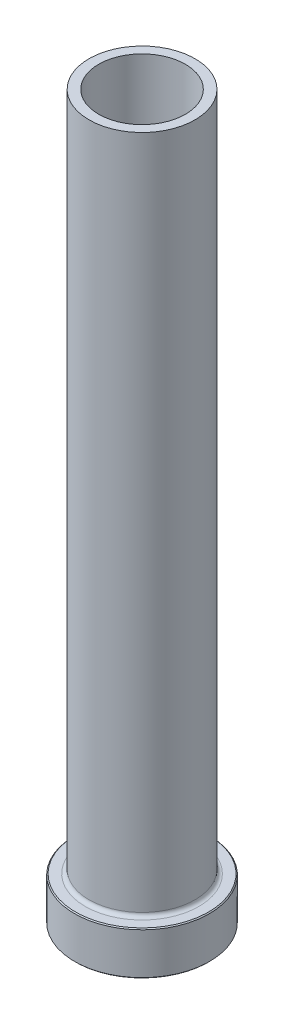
SolidWorks part; units mm, degrees
ref_plane "Front Plane" through (0, 0, 0) normal (0, 0, 1) x (1, 0, 0)
ref_plane "Top Plane" through (0, 0, 0) normal (0, 1, 0) x (1, 0, 0)
ref_plane "Right Plane" through (0, 0, 0) normal (1, 0, 0) x (0, 0, -1)
sketch "Sketch1" plane through (0, 0, 0) normal (0, 0, 1) x (1, 0, 0)
  line L0 (-9, 150) -> (-11, 150)
  line L1 (-11, 150) -> (-11, 9)
  line L2 (-11, 9) -> (-14, 9)
  line L3 (-14, 9) -> (-14, 0)
  line L4 (15.4, 0) -> (-15.4, 0) construction
  line L5 (-14, 0) -> (-9.25, 0)
  line L6 (-9, 95) -> (-9, 150)
  line L7 (0, 92.1877) -> (0, -15.5353) construction
  line L8 (0, -15.4) -> (0, 15.4) construction
  line L9 (-9, 95) -> (-9.25, 83)
  line L10 (-9.25, 83) -> (-9.25, 0)
  dimension "D1" = 0.25
  dimension "ID" = 18
  dimension "OD" = 22
  dimension "L" = 150
  dimension "H" = 28
  dimension "T" = 9
  dimension "N" = 55
  dimension "D2" = 12
revolve "Revolve1" add sketch "Sketch1" angle 360 about L7
fillet "Fillet1" radius 0.8 1 edges at (0, 9, 11)
chamfer "Chamfer1" distance 0.2 angle 45 2 edges at (0, 9, 14) (0, 0, 14)
chamfer "Chamfer3" distance 0.5 angle 45 1 edges at (0, 0, 9.25)
